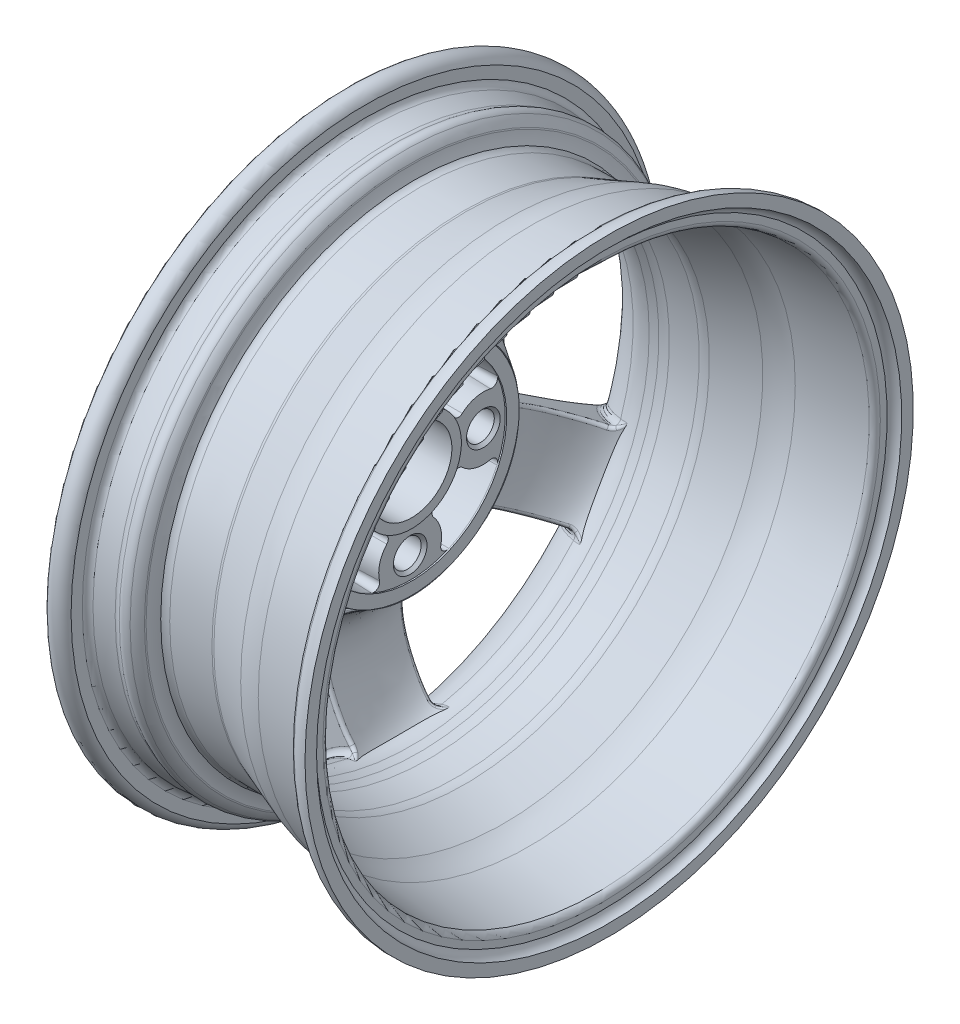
SolidWorks part; units mm, degrees
ref_plane "Plan de face" through (0, 0, 0) normal (0, 0, 1) x (1, 0, 0)
ref_plane "Plan de dessus" through (0, 0, 0) normal (0, 1, 0) x (1, 0, 0)
ref_plane "Plan de droite" through (0, 0, 0) normal (1, 0, 0) x (0, 0, -1)
sketch "Esquisse1" plane through (-97.1049, -31.7009, 0) normal (0, 0, 1) x (1, 0, 0)
  line L0 (9.5842, 111.4409) -> (9.5842, 115.599)
  line L1 (22.0977, 112.4616) -> (22.0977, 104.8066)
  line L2 (59.6384, 82.8624) -> (89.3336, 83.4222)
  line L3 (188.8599, 111.4409) -> (188.8599, 119.3511)
  line L4 (183.7523, 106.5928) -> (183.7523, 101.9277)
  line L5 (53.2539, 74.4419) -> (58.6168, 75.7177)
  line L6 (65.0013, 76.4832) -> (84.1547, 77.7591)
  line L7 (176.3464, 112.4616) -> (176.3464, 106.5928)
  line L8 (170.728, 101.2343) -> (135.2304, 97.662)
  line L9 (10.669, 110.4409) -> (10.669, 107.3206)
  line L10 (90.1394, 78.681) -> (116.8432, 88.476)
  line L11 (180.1529, 97.9478) -> (134.2089, 93.3242)
  line L12 (90.9612, 83.7271) -> (119.9077, 94.3448)
  line L13 (9.669, 111.4409) -> (9.5842, 111.4409)
  line L14 (-23.0249, -88.5591) -> (204.5544, -88.5591) construction
  arc A0 (22.0977, 112.4616) -> (10.8001, 117.4388) centre (14.1167, 109.6564) ccw
  arc A1 (22.0977, 104.8066) -> (25.2629, 100.6359) centre (27.3366, 105.4961) ccw
  arc A2 (38.1866, 98.4275) -> (42.0172, 99.4481) centre (38.825, 103.7302) ccw
  arc A3 (48.6571, 98.6827) -> (42.0172, 99.4481) centre (44.8297, 94.6642) ccw
  arc A4 (53.0334, 93.2541) -> (48.6571, 98.6827) centre (37.4597, 85.1775) ccw
  arc A5 (53.2916, 92.3815) -> (55.5523, 84.6485) centre (74.8019, 94.4732) ccw
  arc A6 (55.5523, 84.6485) -> (60.1491, 82.8624) centre (60.1877, 89.7699) ccw
  arc A7 (42.2726, 74.4419) -> (53.2539, 74.4419) centre (47.7633, 91.3542) ccw
  arc A8 (65.0013, 76.4832) -> (58.6168, 75.7177) centre (67.3112, 30.2112) ccw
  arc A9 (84.1547, 77.7591) -> (90.1394, 78.681) centre (84.8581, 93.0791) ccw
  arc A10 (134.2089, 93.3242) -> (116.8432, 88.476) centre (138.681, 43.7798) ccw
  arc A11 (188.8599, 111.4409) -> (183.7523, 106.5928) centre (190.2395, 104.8731) ccw
  arc A12 (188.8599, 119.3511) -> (179.6663, 117.5649) centre (187.3662, 102.4858) ccw
  arc A13 (179.6663, 117.5649) -> (176.3464, 112.4616) centre (181.8638, 112.5038) ccw
  arc A14 (170.728, 101.2343) -> (176.3464, 106.5928) centre (170.7398, 106.8466) ccw
  arc A15 (135.2304, 97.662) -> (119.9077, 94.3448) centre (140.9623, 34.137) ccw
  arc A16 (53.2916, 92.3815) -> (53.0334, 93.2541) centre (50.9028, 92.1492) ccw
  arc A17 (25.2629, 100.6359) -> (38.1866, 98.4275) centre (40.7246, 152.1989) ccw
  arc A18 (10.8001, 117.4388) -> (9.5842, 115.599) centre (11.5842, 115.599) ccw
  arc A19 (10.669, 110.4409) -> (9.669, 111.4409) centre (9.669, 110.4409) ccw
  arc A20 (10.669, 107.3206) -> (42.2726, 74.4419) centre (57.724, 120.9224) ccw
  arc A21 (180.1529, 97.9478) -> (183.7523, 101.9277) centre (179.7523, 101.9277) ccw
  arc A22 (89.3336, 83.4222) -> (90.9612, 83.7271) centre (89.2393, 88.4213) ccw
  dimension "D1" = 200
revolve "Révolution1" add sketch "Esquisse1" angle 360 about L14
sketch "Esquisse2" plane through (0, 0, 0) normal (0, 0, 1) x (1, 0, 0)
  line L0 (-203.6089, -120.26) -> (184.2703, -120.26) construction
  line L1 (-99.5208, -46.76) -> (-43.245, -46.76)
  line L2 (-43.245, -46.76) -> (-43.245, -55.26)
  line L3 (-43.245, -55.26) -> (-44.245, -55.26)
  line L4 (-44.245, -55.26) -> (-44.245, -86.26)
  line L5 (-44.245, -86.26) -> (-43.245, -86.26)
  line L6 (-43.245, -86.26) -> (-43.245, -92.76)
  line L7 (-43.245, -92.76) -> (-99.5208, -92.76)
  line L8 (-99.5208, -92.76) -> (-99.5208, -46.76)
  line L9 (-87.5208, 83.898) -> (-87.5208, -324.418) construction
  line L10 (91.755, -328.1701) -> (91.755, 87.6501) construction
  dimension "D1" = 200
  dimension "D2" = 1
  dimension "D3" = 1
  dimension "D4" = 27.5
  dimension "D5" = 34
  dimension "D6" = 65
  dimension "D7" = 73.5
  dimension "D8" = 12
  dimension "D9" = 135
revolve "Révolution2" add sketch "Esquisse2" angle 360 about L0
sketch "Esquisse3" plane through (-44.245, 0, 0) normal (1, 0, 0) x (0, 0, -1)
  arc A0 (59.3605, -93.7772) -> (26.4828, -60.8995) centre (0, -120.26) ccw
  arc A2 (29.4704, -103.3043) -> (16.9557, -90.7896) centre (0, -120.26) ccw
  arc A4 (15.9779, -84.646) -> (20.9545, -65.4478) centre (0, -70.26) ccw
  arc A5 (54.8122, -99.3055) -> (35.614, -104.2821) centre (50, -120.26) ccw
  arc A6 (16.9557, -90.7896) -> (15.9779, -84.646) centre (18.9505, -87.3225) cw
  arc A7 (35.614, -104.2821) -> (29.4704, -103.3043) centre (32.9375, -101.3095) cw
  arc A8 (59.3605, -93.7772) -> (54.8122, -99.3055) centre (55.7075, -95.4069) cw
  arc A9 (26.4828, -60.8995) -> (20.9545, -65.4478) centre (24.8531, -64.5525) ccw
  arc A10 (59.3605, -146.7428) -> (54.8122, -141.2145) centre (55.7075, -145.1131) ccw
  arc A11 (26.4828, -179.6204) -> (59.3605, -146.7428) centre (0, -120.26) ccw
  arc A12 (26.4828, -179.6204) -> (20.9545, -175.0722) centre (24.8531, -175.9675) cw
  arc A13 (20.9545, -175.0722) -> (15.9779, -155.874) centre (0, -170.26) ccw
  arc A14 (15.9779, -155.874) -> (16.9557, -149.7304) centre (18.9505, -153.1975) cw
  arc A15 (16.9557, -149.7304) -> (29.4704, -137.2157) centre (0, -120.26) ccw
  arc A16 (29.4704, -137.2157) -> (35.614, -136.2379) centre (32.9375, -139.2105) cw
  arc A17 (35.614, -136.2379) -> (54.8122, -141.2145) centre (50, -120.26) ccw
  arc A18 (-26.4828, -179.6204) -> (-20.9545, -175.0722) centre (-24.8531, -175.9675) ccw
  arc A19 (-59.3605, -146.7428) -> (-26.4828, -179.6204) centre (0, -120.26) ccw
  arc A20 (-59.3605, -146.7428) -> (-54.8122, -141.2145) centre (-55.7075, -145.1131) cw
  arc A21 (-54.8122, -141.2145) -> (-35.614, -136.2379) centre (-50, -120.26) ccw
  arc A22 (-35.614, -136.2379) -> (-29.4704, -137.2157) centre (-32.9375, -139.2105) cw
  arc A23 (-29.4704, -137.2157) -> (-16.9557, -149.7304) centre (0, -120.26) ccw
  arc A24 (-16.9557, -149.7304) -> (-15.9779, -155.874) centre (-18.9505, -153.1975) cw
  arc A25 (-15.9779, -155.874) -> (-20.9545, -175.0722) centre (0, -170.26) ccw
  arc A26 (-59.3605, -93.7772) -> (-54.8122, -99.3055) centre (-55.7075, -95.4069) ccw
  arc A27 (-26.4828, -60.8995) -> (-59.3605, -93.7772) centre (0, -120.26) ccw
  arc A28 (-26.4828, -60.8995) -> (-20.9545, -65.4478) centre (-24.8531, -64.5525) cw
  arc A29 (-20.9545, -65.4478) -> (-15.9779, -84.646) centre (0, -70.26) ccw
  arc A30 (-15.9779, -84.646) -> (-16.9557, -90.7896) centre (-18.9505, -87.3225) cw
  arc A31 (-16.9557, -90.7896) -> (-29.4704, -103.3043) centre (0, -120.26) ccw
  arc A32 (-29.4704, -103.3043) -> (-35.614, -104.2821) centre (-32.9375, -101.3095) cw
  arc A33 (-35.614, -104.2821) -> (-54.8122, -99.3055) centre (-50, -120.26) ccw
  dimension "D2" = 21.5
  dimension "D4" = 21.5
  dimension "D5" = 4
  dimension "D1" = 50
  dimension "D3" = 50
extrude "Enlèv. mat.-Extru.1" cut sketch "Esquisse3" against normal blind 40 draft 2
sketch "Esquisse4" plane through (-44.245, 0, 0) normal (1, 0, 0) x (0, 0, -1)
  circle A0 centre (50, -120.26) radius 9.5
  circle A1 centre (0, -70.26) radius 9.5
  circle A2 centre (0, -170.26) radius 9.5
  circle A3 centre (-50, -120.26) radius 9.5
  dimension "D1" = 19
  dimension "D2" = 19
  dimension "D3" = 19
  dimension "D4" = 19
extrude "Enlèv. mat.-Extru.2" cut sketch "Esquisse4" against normal through all
sketch "Esquisse5" plane through (-99.5208, 0, 0) normal (-1, 0, 0) x (0, 0, 1)
  circle A0 centre (0, -70.26) radius 18.5
  circle A1 centre (50, -120.26) radius 18.5
  circle A2 centre (0, -170.26) radius 18.5
  circle A3 centre (-50, -120.26) radius 18.5
  dimension "D1" = 37
  dimension "D2" = 37
  dimension "D3" = 37
  dimension "D4" = 37
extrude "Enlèv. mat.-Extru.3" cut sketch "Esquisse5" against normal blind 40
ref_plane "Plan1" through (0, 0, 27.5) normal (0, 0, 1) x (1, 0, 0)
ref_plane "Plan2" through (0, 0, -27.5) normal (0, 0, 1) x (1, 0, 0)
sketch "trajectoire1" plane through (-99.5208, 0, 0) normal (-1, 0, 0) x (0, 0, 1)
  line L0 (27.5, -37.4239) -> (27.5, -57.8939) construction
  line L1 (27.5, -108.3169) -> (27.5, 108.3169) construction
  line L2 (-27.5, -108.3169) -> (-27.5, 108.3169) construction
  line L3 (-27.5, -42.9951) -> (-27.5, -57.8939) construction
  arc A1 (27.5, -57.8939) -> (-27.5, -57.8939) centre (0, -120.26) ccw
  dimension "D1" = 68.16
sketch "sectionV" plane through (0, 0, -27.5) normal (0, 0, 1) x (1, 0, 0)
  line L0 (-99.5208, -46.76) -> (-99.5208, -60.8282) construction
  line L1 (-99.5208, -46.76) -> (-99.5208, -193.76) construction
  line L2 (-43.8511, 42.741) -> (-17.7108, 48.8246) construction
  line L3 (-86.3049, 85.7379) -> (-86.3049, -326.2579) construction
  line L4 (-43.8511, 42.741) -> (-69.2709, 52.8504)
  line L5 (-43.245, -193.76) -> (-43.245, -46.76) construction
  line L6 (-43.245, -52.1) -> (-99.5208, -52.1)
  line L7 (-99.5208, -52.1) -> (-99.5208, -46.76)
  line L8 (-43.245, -46.76) -> (-99.5208, -46.76) construction
  line L9 (-69.2709, 52.8504) -> (-86.4359, 75.6197)
  spline S0 degree 3 poles (-86.4359, 75.6197) (-85.8118, 62.6593) (-83.8227, 21.3544) (-99.5208, -18.3634) (-99.5208, -46.76) knots 0 0 0 0 0.313774 1 1 1 1
  spline S1 degree 3 poles (-43.8511, 42.741) (-54.2778, 40.3144) (-70.9621, 16.5734) (-83.5225, -28.3912) (-55.9938, -44.5956) (-43.245, -52.1) knots 0 0 0 0 0.271813 0.66277 1 1 1 1
  dimension "D1" = 5.34
sweep "Balayage1" add profiles "sectionV" path "trajectoire1"
pattern_circular "Répétition circulaire1" count 6 over 360 about axis through (-203.6089, -120.26, 0) along (1, 0, 0) of "Balayage1"
fillet "Congé1" radius 4 4 edges at (-47.4886, 75.4147, 27.5) (-47.4886, 75.4147, -27.5) (0.0431, 116.6988, 27.5) (0.0431, 116.6988, -27.5)
fillet "Congé2" radius 4 4 edges at (-79.2187, -54.6346, 168.6664) (-79.2187, -7.0032, 141.1664)
fillet "Congé3" radius 4 4 edges at (-79.2187, -233.5167, 141.1664) (-79.2187, -185.8853, 168.6664)
fillet "Congé4" radius 4 4 edges at (-47.4886, -315.9347, -27.5) (0.8407, -356.0972, -27.5) (0.8407, -356.0972, 27.5)
fillet "Congé5" radius 4 4 edges at (-79.2187, -185.8853, -168.6664) (-79.2187, -233.5167, -141.1664)
fillet "Congé6" radius 4 4 edges at (-79.2187, -54.6346, -168.6664) (-79.2187, -7.0032, -141.1664)
fillet "Congé7" radius 10.5 1 edges at (-71.3842, -52.0984, 27.5)
fillet "Congé8" radius 10.5 1 edges at (-71.3842, -62.3635, 45.2797)
fillet "Congé9" radius 10.5 1 edges at (-71.3842, -109.9949, 72.7797)
fillet "Congé10" radius 10.5 1 edges at (-71.3842, -130.5251, 72.7797)
fillet "Congé11" radius 10.5 1 edges at (-71.3842, -178.1565, 45.2797)
fillet "Congé12" radius 10.5 1 edges at (-71.3842, -188.4216, 27.5)
fillet "Congé13" radius 10.5 1 edges at (-71.3842, -188.4216, -27.5)
fillet "Congé15" radius 10.5 1 edges at (-71.3842, -178.1565, -45.2797)
fillet "Congé16" radius 10.5 1 edges at (-71.3842, -130.5251, -72.7797)
fillet "Congé18" radius 10.5 1 edges at (-71.3842, -109.9949, -72.7797)
fillet "Congé19" radius 10.5 1 edges at (-71.3842, -62.3635, -45.2797)
fillet "Congé20" radius 10.5 1 edges at (-71.3842, -52.0984, -27.5)
fillet "Congé23" radius 2 42 edges at (-86.282, -190.1965, -180.8809) (-86.3374, -50.4023, -181.9627) (-99.5208, -111.8885, -74.0978) (-99.5208, -120.26, -73.5) (-99.5208, -130.9134, -75.3346) (-86.282, -311.8757, -29.8736) (-86.3374, -242.9155, -151.4799) (-99.5208, -180.2448, -44.2989) (-99.5208, -183.9129, -36.75) (-99.5208, -190.8284, -28.4411) (-86.282, -241.9392, 151.0072) (-86.3374, -312.7732, 30.4829) (-99.5208, -188.6164, 29.799) (-99.5208, -183.9129, 36.75) (-99.5208, -180.1749, 46.8934) (-86.282, -50.3235, 180.8809) (-86.3374, -190.1177, 181.9627) (-99.5208, -128.6315, 74.0978) (-99.5208, -120.26, 73.5) (-99.5208, -109.6066, 75.3346) (-86.282, 71.3557, 29.8736) (-86.3374, 2.3955, 151.4799) (-99.5208, -60.2752, 44.2989) (-99.5208, -56.6071, 36.75) (-99.5208, -49.6916, 28.4411) (-86.282, 1.4192, -151.0072) (-86.3374, 72.2532, -30.4829) (-99.5208, -51.9036, -29.799) (-99.5208, -56.6071, -36.75) (-99.5208, -60.3451, -46.8934)
fillet "Congé24" radius 2 30 edges at (-45.5311, -51.6945, 29.636) (-52.1425, 38.1591, 29.152) (-44.9593, -60.2053, 43.8932) (-52.3118, -15.9467, 122.6222) (-44.9593, -128.2453, 73.9555) (-52.3118, -174.2973, 151.649) (-45.5311, -180.2083, 44.5615) (-52.1425, -224.7159, 122.6189) (-44.9593, -188.3, 30.0622) (-52.3118, -278.6106, 29.0269) (-45.5311, -188.8255, -29.636) (-52.1425, -278.679, -29.152) (-44.9593, -180.3147, -43.8932) (-52.3118, -224.5733, -122.6222) (-45.5311, -128.8772, -74.1975) (-52.1425, -174.2232, -151.7709) (-44.9593, -112.2747, -73.9555) (-52.3118, -66.2227, -151.649) (-45.5311, -60.3117, -44.5615) (-52.1425, -15.8041, -122.6189)
chamfer "Chanfrein1" distance 2 angle 45 4 edges at (-44.245, -170.26, -9.5) (-44.245, -120.26, 40.5) (-44.245, -70.26, -9.5) (-44.245, -120.26, -59.5)
